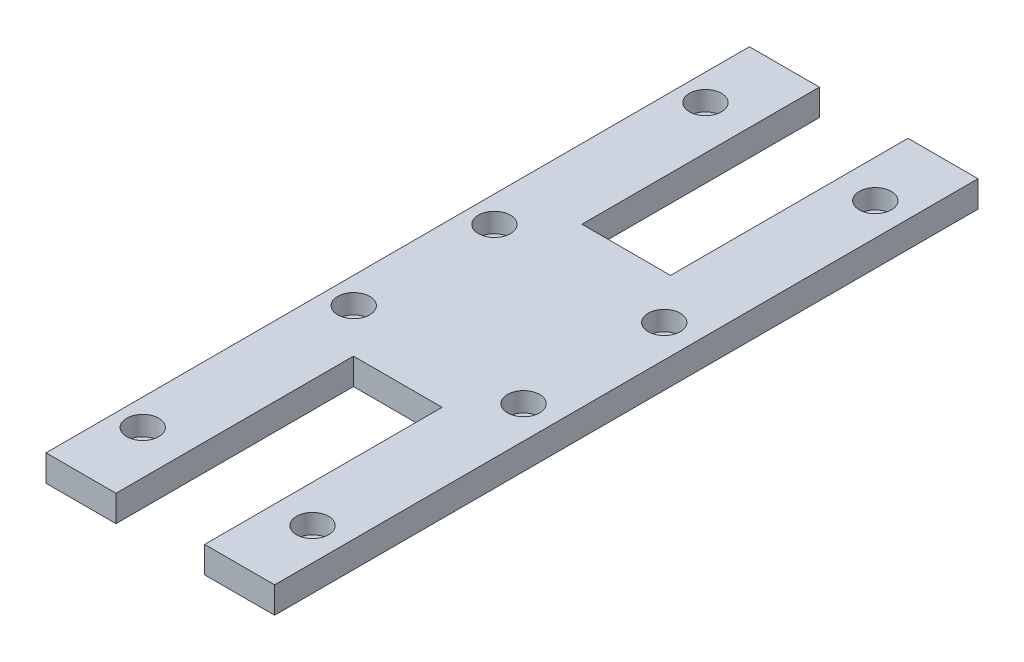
SolidWorks part; units mm, degrees
ref_plane "Front Plane" through (0, 0, 0) normal (0, 0, 1) x (1, 0, 0)
ref_plane "Top Plane" through (0, 0, 0) normal (0, 1, 0) x (1, 0, 0)
ref_plane "Right Plane" through (0, 0, 0) normal (1, 0, 0) x (0, 0, -1)
sketch "Sketch1" plane through (0, 0, 0) normal (0, 0, 1) x (1, 0, 0)
  line L1 (0, 0) -> (41.275, 0)
  line L2 (0, 0) -> (0, 4.7625)
  line L3 (0, 4.7625) -> (41.275, 4.7625)
  line L4 (41.275, 0) -> (41.275, 4.7625)
  dimension "D1" = 41.275
  dimension "D2" = 4.7625
extrude "Boss-Extrude1" add sketch "Sketch1" against normal blind 127
sketch "Sketch2" plane through (0, 4.7625, 0) normal (0, 1, 0) x (1, 0, 0)
  line L0 (41.275, 127) -> (0, 127) construction
  line L1 (12.6365, 127) -> (28.6385, 127)
  line L2 (12.6365, 127) -> (12.6365, 84.1248)
  line L3 (12.6365, 84.1248) -> (28.6385, 84.1248)
  line L4 (28.6385, 127) -> (28.6385, 84.1248)
  line L5 (41.275, 0) -> (0, 0) construction
  line L6 (12.6365, 0) -> (28.6385, 0)
  line L7 (12.6365, 0) -> (12.6365, 42.8752)
  line L8 (12.6365, 42.8752) -> (28.6385, 42.8752)
  line L9 (28.6385, 0) -> (28.6385, 42.8752)
  line L10 (0, 127) -> (0, 0) construction
  dimension "D1" = 16.002
  dimension "D2" = 16.002
  dimension "D3" = 42.8752
  dimension "D4" = 42.8752
  dimension "D5" = 12.6365
  dimension "D6" = 12.6365
extrude "Cut-Extrude1" cut sketch "Sketch2" against normal blind 127
sketch "Sketch3" plane through (0, 4.7625, 0) normal (0, 1, 0) x (1, 0, 0)
  line L0 (12.6365, 127) -> (0, 127) construction
  line L2 (0, 127) -> (0, 0) construction
  circle A0 centre (4.7625, 114.3) radius 1.778
  circle A1 centre (4.7625, 76.2) radius 1.778
  circle A2 centre (4.7625, 50.8) radius 1.778
  circle A3 centre (4.7625, 12.7) radius 1.778
  circle A4 centre (35.4285, 114.3) radius 1.778
  circle A5 centre (35.4285, 76.2) radius 1.778
  circle A6 centre (35.4285, 50.8) radius 1.778
  circle A7 centre (35.4285, 12.7) radius 1.778
  dimension "D1" = 12.7
  dimension "D2" = 38.1
  dimension "D3" = 25.4
  dimension "D4" = 38.1
  dimension "D5" = 3.556
  dimension "D6" = 3.556
  dimension "D7" = 3.556
  dimension "D8" = 3.556
  dimension "D9" = 4.7625
  dimension "D10" = 3.556
  dimension "D11" = 3.556
  dimension "D12" = 3.556
  dimension "D13" = 3.556
extrude "Cut-Extrude2" cut sketch "Sketch3" against normal blind 6.35
sketch "Sketch4" plane through (0, 4.7625, 0) normal (0, 1, 0) x (1, 0, 0)
  circle A0 centre (4.7625, 114.3) radius 2.8956
  circle A1 centre (4.7625, 76.2) radius 2.8956
  circle A2 centre (4.7625, 50.8) radius 2.8956
  circle A3 centre (4.7625, 12.7) radius 2.8956
  circle A4 centre (35.4285, 12.7) radius 2.8956
  circle A5 centre (35.4285, 50.8) radius 2.8956
  circle A6 centre (35.4285, 76.2) radius 2.8956
  circle A7 centre (35.4285, 114.3) radius 2.8956
  dimension "D1" = 5.7912
  dimension "D2" = 5.7912
  dimension "D3" = 5.7912
  dimension "D4" = 5.7912
  dimension "D5" = 5.7912
  dimension "D6" = 5.7912
  dimension "D7" = 5.7912
  dimension "D8" = 5.7912
extrude "Cut-Extrude3" cut sketch "Sketch4" against normal blind 3.5052
